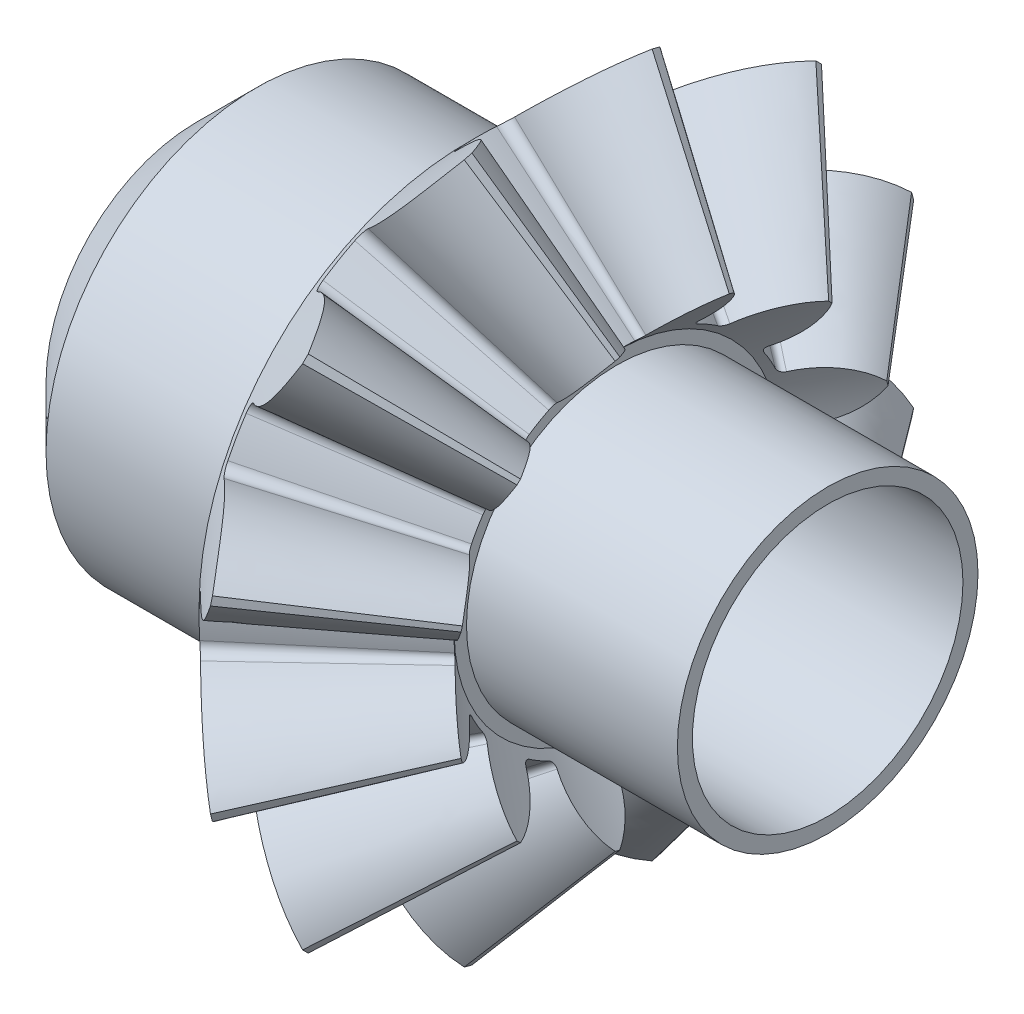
SolidWorks part; units mm, degrees
other "<straight bevel pinion_iso>-<Bore>"
ref_plane "前视基准面" through (0, 0, 0) normal (0, 0, 1) x (1, 0, 0)
ref_plane "上视基准面" through (0, 0, 0) normal (0, 1, 0) x (1, 0, 0)
ref_plane "右视基准面" through (0, 0, 0) normal (1, 0, 0) x (0, 0, -1)
sketch "HoldingSke-straight bevel pinion_iso" plane through (0, 0, 0) normal (0, 1, 0) x (1, 0, 0)
  line L0 (0, 0) -> (1.0868, -0.231)
  line L1 (-15, 0) -> (100, 0) construction
  line L2 (0, 0) -> (-120.4621, 24.3224)
  line L3 (0, 0) -> (-11.863, 4.5341)
  line L4 (0, 0) -> (8.4473, 1.7955)
  line L5 (0, 0) -> (-7.4956, -2.7956)
  line L6 (0, 0) -> (-10.5278, -7.1032)
  line L7 (-120.4621, 24.3224) -> (-120.402, 32.3222)
  line L8 (-76.2, 0.9) -> (-75.5, 0.9)
  line L9 (-71.009, 38.7566) -> (-53.1078, 45.2721)
  line L10 (-76.2, 71.12) -> (104.1128, 71.12)
  line L11 (0, 0) -> (-3, 0)
  line L12 (-76.2, 101.6) -> (-76.166, 101.6)
  line L13 (24.9733, 27.94) -> (52.9518, 28.4284)
  line L14 (24.9733, 27.94) -> (24.9743, 27.94)
  line L15 (24.9733, 27.94) -> (100.4024, 29.5042)
  line L16 (-120.4621, 24.3224) -> (5.8239, -2.5205)
  circle A0 centre (0, 0) radius 2
  circle A1 centre (0, 0) radius 3.5
  circle A2 centre (0, 0) radius 3.5
  circle A3 centre (0, 0) radius 2
  dimension "MHD" = 7
  dimension "Hub_dia" = 7
  dimension "Bore" = 4
  dimension "MBD" = 4
  dimension "Num_teeth" = 12
  dimension "Pitch_radius" = 180.3128
  dimension "Pitch" = 1.1111
  dimension "Width" = 3
  dimension "Mounting_dist" = 8
  dimension "Show_teeth" = 12
  dimension "Thickness" = 12.7
  dimension "OAL" = 8.0001
  dimension "T_dim" = 0.7
  dimension "Ap" = 20
  dimension "H" = 19.05
  dimension "Backlash" = 0.034
  dimension "Addendum_fac" = 1
  dimension "Dedendum_fac" = 1.188
  dimension "Clearance_fac" = 0.188
  dimension "Dedendum_add" = 0.001
  dimension "Mating_teeth" = 12
  dimension "MnMD" = 6.3459
  dimension "Module" = 0.9
inserted part "straight bevel pinion_iso" parameters "Num_teeth.HoldingSke"=12, "Pitch.HoldingSke"=1.1111, "MHD.HoldingSke"=7, "Hub_dia.HoldingSke"=7, "Mounting_dist.HoldingSke"=8, "Show_teeth.HoldingSke"=12, "Thickness.HoldingSke"=12.7, "OAL.HoldingSke"=8.0001, "T_dim.HoldingSke"=0.7, "Ap.HoldingSke"=20, "H.HoldingSke"=19.05, "Pitch_radius.HoldingSke"=180.3128, "Width.HoldingSke"=3, "Bore.HoldingSke"=4, "Backlash.HoldingSke"=0.034, "Addendum_fac.HoldingSke"=1, "Dedendum_fac.HoldingSke"=1.188, "Clearance_fac.HoldingSke"=0.188, "Dedendum_add.HoldingSke"=0.001, "Mating_teeth.HoldingSke"=12, "MnMD.HoldingSke"=6.3459, "MBD.HoldingSke"=4, "Module.HoldingSke"=0.9, "D1.Base-Revolve"=360, "Addendum.BasProSke"=0.9, "Pitch_rad.BasProSke"=5.4, "Dedendum_plus.BasProSke"=1.3377, "Face_wid.BasProSke"=3, "Pitch_ang.BasProSke"=45, "D1.BasProSke"=8.9081, "D2.BasProSke"=6.3459, "D3.BasProSke"=7.6368, "D4.BasProSke"=6.721, "Offset.ToothPln2"=7.6368, "Dedendum_plus.TooCutSke2"=1.3377, "Diameter.TooCutSke2"=0.0254, "Radius.TooCutSke"=6.3, "Overcut_dia.TooCutSke"=12.852, "Root_dia.TooCutSke"=8.6596, "Pitch_dia.TooCutSke"=10.8, "Base_dia.TooCutSke"=10.1487, "Half_ang.TooCutSke"=15, "Half_CT.TooCutSke"=0.6878, "Flank_rad.TooCutSke"=2.16, "Root_fillet.TooCutSke"=0.1702, "Angle.TeethCuts"=30, "Num_teeth.TeethCuts"=12, "Length.Hub"=1.6542, "Diameter.HubSke"=7, "D1.Bore"=16.0001, "Diameter.BorSke"=4
move or copy body "实体-移动/复制4"
sketch "草图7" plane through (0, 0, 0) normal (-1, 0, 0) x (0, 0, 1)
  circle A0 centre (0, 0) radius 3.5
  dimension "D1" = 7
extrude "凸台-拉伸1" add sketch "草图7" along normal blind 4.5
sketch "草图8" plane through (-4.5, 0, 0) normal (-1, 0, 0) x (0, 0, 1)
  circle A0 centre (0, 0) radius 2.5
  dimension "D1" = 5
extrude "凸台-拉伸2" add sketch "草图8" against normal blind 10.5
sketch "草图9" plane through (6, 0, 0) normal (1, 0, 0) x (0, 0, -1)
  circle A0 centre (0, 0) radius 2.25
  dimension "D1" = 4.5
extrude "切除-拉伸1" cut sketch "草图9" against normal blind 4
sketch "草图10" plane through (2, 0, 0) normal (1, 0, 0) x (0, 0, -1)
  line L0 (0, 2) -> (0, -2) construction
  line L1 (-1.3, 1.5199) -> (-1.3, -1.5199)
  line L2 (1.3, 1.5199) -> (1.3, -1.5199)
  line L4 (1.3, 2) -> (1.3, -2) construction
  line L5 (-1.3, 2) -> (-1.3, -2) construction
  arc A0 (-1.3, -1.5199) -> (1.3, -1.5199) centre (0, 0) ccw
  arc A1 (1.3, 1.5199) -> (-1.3, 1.5199) centre (0, 0) ccw
  dimension "D1" = 4
  dimension "D2" = 1.3
  dimension "D3" = 1.3
extrude "切除-拉伸2" cut sketch "草图10" against normal through all
chamfer "倒角1" distance 1 angle 45 1 edges at (-4.5, 0, 3.5)
